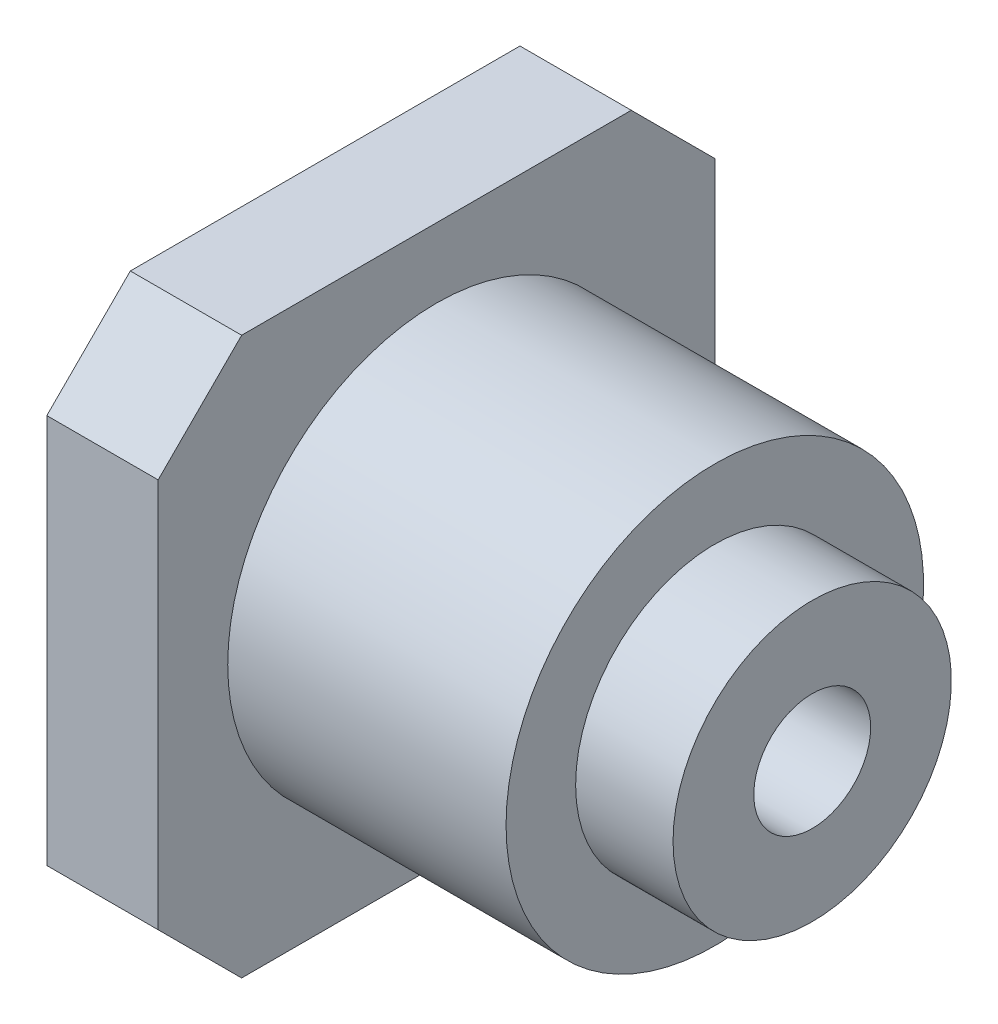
SolidWorks part; units mm, degrees
ref_plane "Front Plane" through (0, 0, 0) normal (0, 0, 1) x (1, 0, 0)
ref_plane "Top Plane" through (0, 0, 0) normal (0, 1, 0) x (1, 0, 0)
ref_plane "Right Plane" through (0, 0, 0) normal (1, 0, 0) x (0, 0, -1)
sketch "Sketch1" plane through (0, 0, 0) normal (0, 0, 1) x (1, 0, 0)
  line L0 (0, 0) -> (17.5, 0)
  line L1 (17.5, 0) -> (17.5, 5)
  line L2 (17.5, 5) -> (14, 5)
  line L3 (14, 5) -> (14, 7.5)
  line L4 (14, 7.5) -> (0, 7.5)
  line L5 (0, 7.5) -> (0, 0)
  dimension "D1" = 5
  dimension "D2" = 7.5
  dimension "D3" = 14
  dimension "D4" = 17.5
revolve "Revolve1" add sketch "Sketch1" angle 360 about L0
sketch "Sketch2" plane through (0, 0, 0) normal (-1, 0, 0) x (0, 0, 1)
  line L0 (-10, 7) -> (-7, 10)
  line L1 (-7, 10) -> (7, 10)
  line L2 (-10, 7) -> (-10, -7)
  line L3 (-7, -10) -> (7, -10)
  line L4 (10, 7) -> (10, -7)
  line L5 (-10, -7) -> (-7, -10)
  line L6 (7, -10) -> (10, -7)
  line L7 (7, 10) -> (10, 7)
  circle A0 centre (0, 0) radius 7.5 construction
  point P0 (-10, 10)
  point P1 (10, -10)
  point P2 (-10, -10)
  point P3 (10, 10)
  dimension "D1" = 10
  dimension "D2" = 10
  dimension "D3" = 10
  dimension "D6" = 3
  dimension "D7" = 3
  dimension "D8" = 3
  dimension "D9" = 3
extrude "Extrude1" add sketch "Sketch2" against normal blind 4
sketch "Sketch3" plane through (17.5, 0, 0) normal (1, 0, 0) x (0, 0, -1)
  point P0 (0, 0)
hole_wizard "M5 Tapped Hole1" positions "3DSketch1" profile "Sketch5" tap size "M5" standard "ISO"
sketch3d "3DSketch1"
  point P0 (17.5, 0, 0)
sketch "Sketch5" plane through (17.5, 0, 0) normal (0, 1, 0) x (0, 0, -1)
  line L0 (0, 0) -> (0, 17.5)
  line L1 (0, 17.5) -> (2.1, 17.5)
  line L2 (2.1, 17.5) -> (2.1, 0)
  line L5 (2.1, 0) -> (0, 0)
  line L11 (0, -6.35) -> (0, 107.95) construction
  dimension "Thru Tap Drill Dia." = 4.2
  dimension "Thru Tap Drill Depth" = 17.5
